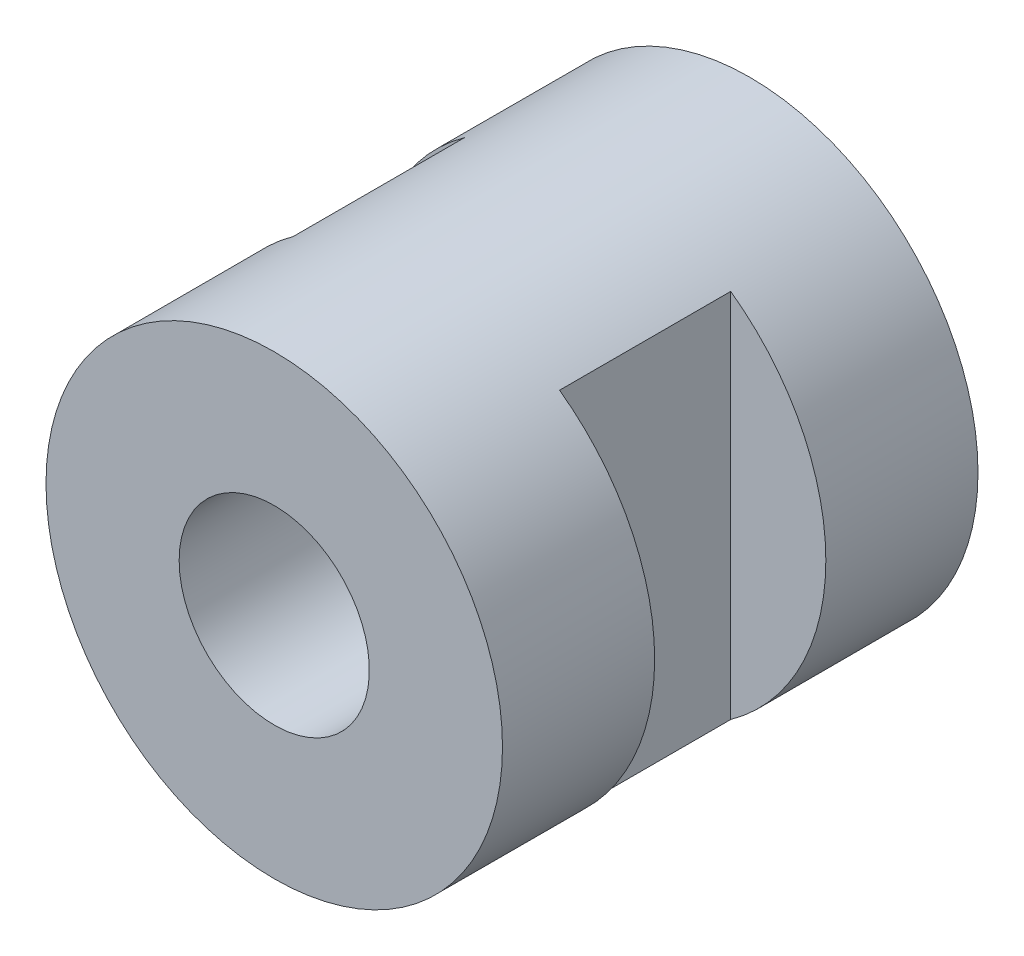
SolidWorks part; units mm, degrees
ref_plane "前视基准面" through (0, 0, 0) normal (0, 0, 1) x (1, 0, 0)
ref_plane "上视基准面" through (0, 0, 0) normal (0, 1, 0) x (1, 0, 0)
ref_plane "右视基准面" through (0, 0, 0) normal (1, 0, 0) x (0, 0, -1)
sketch "草图1" plane through (0, 0, 0) normal (0, 0, 1) x (1, 0, 0)
  circle A0 centre (0, 0) radius 6
extrude "凸台-拉伸1" add sketch "草图1" along normal blind 12.5
ref_plane "基准面1" through (0, 10, 0) normal (0, 1, 0) x (-1, 0, 0)
sketch "草图2" plane through (0, 10, 0) normal (0, 1, 0) x (-1, 0, 0)
  line L0 (-6, 12.5) -> (-6, 0) construction
  line L1 (-6.6945, 8.5) -> (-3.5, 8.5)
  line L2 (-6.6945, 8.5) -> (-6.6945, 4)
  line L3 (-6.6945, 4) -> (-3.5, 4)
  line L4 (-3.5, 8.5) -> (-3.5, 4)
  line L5 (0, 12.5) -> (0, 0) construction
  line L6 (6, 12.5) -> (-6, 12.5) construction
  line L7 (0, 6.25) -> (6.2438, 6.25) construction
  line L8 (6.6945, 4) -> (3.5, 4)
  line L9 (6.6945, 8.5) -> (6.6945, 4)
  line L10 (3.5, 8.5) -> (3.5, 4)
  line L11 (6.6945, 8.5) -> (3.5, 8.5)
  dimension "D1" = 2.5
  dimension "D2" = 4.5
extrude "切除-拉伸1" cut sketch "草图2" against normal through all
sketch "草图3" plane through (0, 0, 0) normal (0, 0, -1) x (-1, 0, 0)
  circle A0 centre (0, 0) radius 2.5
extrude "切除-拉伸2" cut sketch "草图3" against normal blind 12.5
